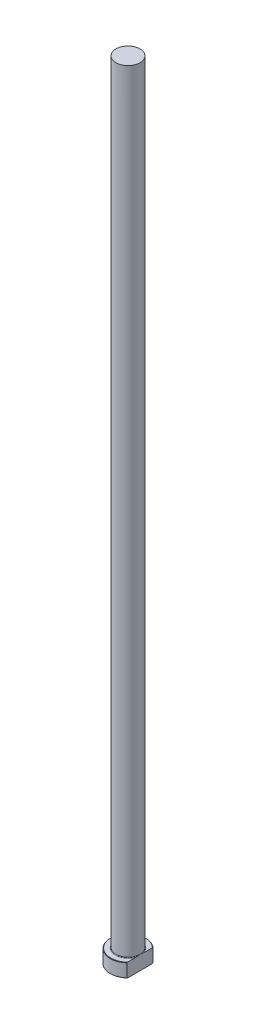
SolidWorks part; units mm, degrees
ref_plane "Front Plane" through (0, 0, 0) normal (0, 0, 1) x (1, 0, 0)
ref_plane "Top Plane" through (0, 0, 0) normal (0, 1, 0) x (1, 0, 0)
ref_plane "Right Plane" through (0, 0, 0) normal (1, 0, 0) x (0, 0, -1)
sketch "Sketch1" plane through (0, 0, 0) normal (0, 0, 1) x (1, 0, 0)
  line L0 (0, 259.9588) -> (0, -15.1925) construction
  line L1 (0, 0) -> (-9, 0)
  line L2 (-9, 0) -> (-9, 7)
  line L3 (-9, 7) -> (-6.1, 7)
  line L4 (-6.1, 7) -> (-6.1, 400)
  line L5 (-6.1, 400) -> (0, 400)
  line L6 (0, 400) -> (0, 0)
  dimension "L" = 400
  dimension "H" = 18
  dimension "T" = 7
  dimension "D" = 12.2
revolve "Revolve1" add sketch "Sketch1" angle 360 about L0
chamfer "Chamfer1" distance 0.2 angle 45 2 edges at (0, 7, 9) (0, 0, 9)
fillet "Fillet1" radius 0.3 1 edges at (0, 7, 6.1)
sketch "Sketch2" plane through (0, 0, 0) normal (0, 1, 0) x (1, 0, 0)
  line L0 (6.1, 6.6174) -> (6.1, -6.6174)
  circle A0 centre (0, 0) radius 9 construction
  arc A1 (6.1, -6.6174) -> (6.1, 6.6174) centre (0, 0) ccw
  circle A2 centre (0, 0) radius 6.1 construction
extrude "KEY" cut sketch "Sketch2" along normal through all
